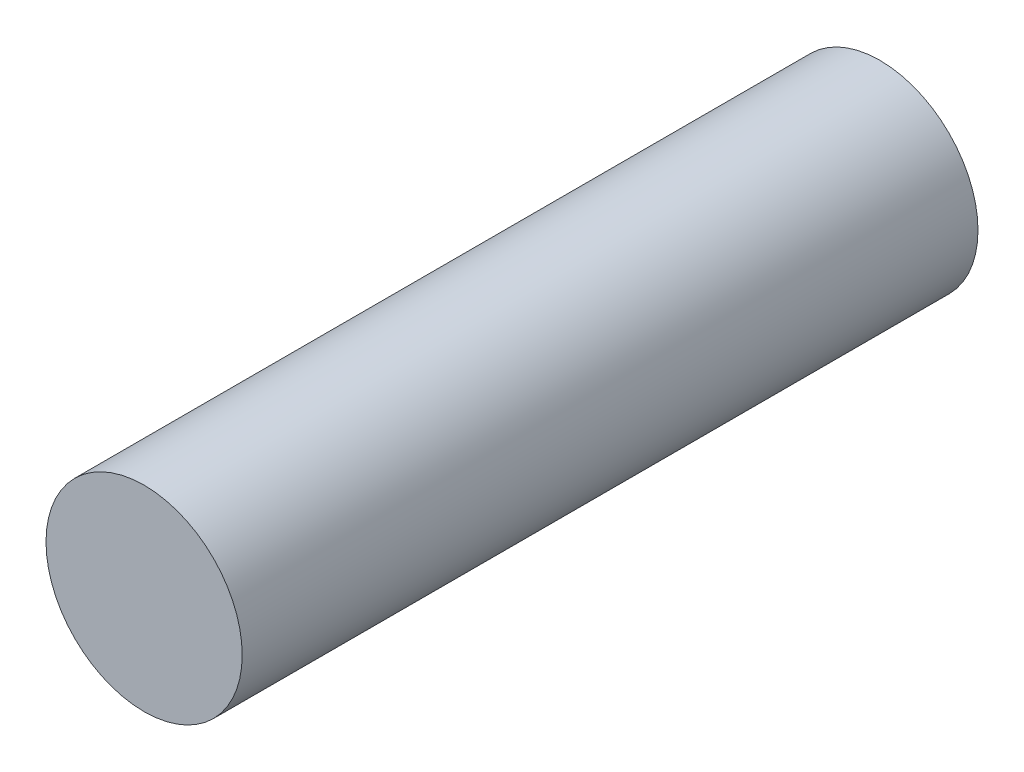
SolidWorks part; units mm, degrees
ref_plane "Plan de face" through (0, 0, 0) normal (0, 0, 1) x (1, 0, 0)
ref_plane "Plan de dessus" through (0, 0, 0) normal (0, 1, 0) x (1, 0, 0)
ref_plane "Plan de droite" through (0, 0, 0) normal (1, 0, 0) x (0, 0, -1)
sketch "Esquisse1" plane through (0, 0, 0) normal (0, 0, 1) x (1, 0, 0)
  circle A0 centre (0, 0) radius 2
  dimension "D1" = 4
extrude "Extrusion1" add sketch "Esquisse1" against normal blind 15
